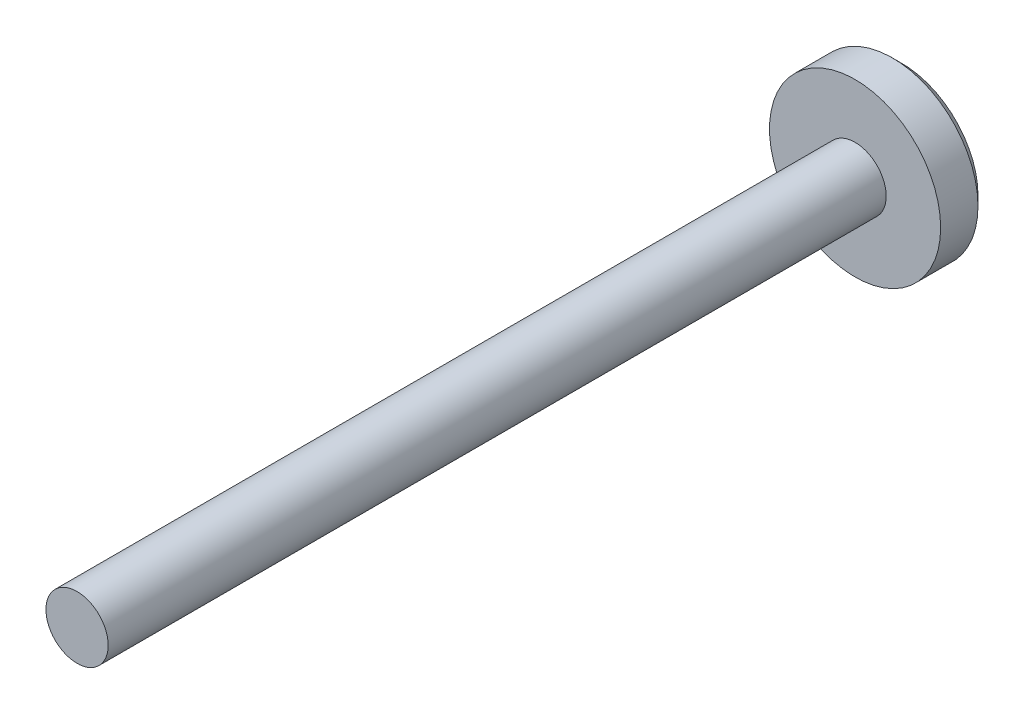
SolidWorks part; units mm, degrees
ref_plane "Face" through (0, 0, 0) normal (0, 0, 1) x (1, 0, 0)
ref_plane "Dessus" through (0, 0, 0) normal (0, 1, 0) x (1, 0, 0)
ref_plane "Droite" through (0, 0, 0) normal (1, 0, 0) x (0, 0, -1)
sketch "Esquisse1" plane through (0, 0, 0) normal (0, 0, 1) x (1, 0, 0)
  circle A0 centre (0, 0) radius 27.5
  dimension "D1" = 55
extrude "Base-Extrusion" add sketch "Esquisse1" along normal blind 15
sketch "Esquisse2" plane through (0, 0, 15) normal (0, 0, 1) x (1, 0, 0)
  circle A0 centre (0, 0) radius 10
  circle A1 centre (0, 0) radius 27.5 construction
  dimension "D1" = 20
extrude "Boss.-Extru.1" add sketch "Esquisse2" along normal blind 250
chamfer "Chanfrein1" distance 3 angle 45
